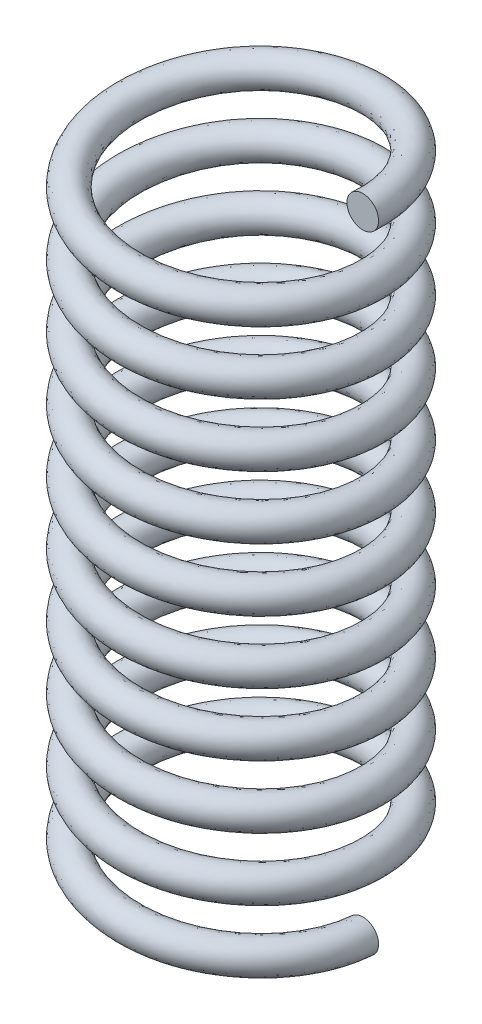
SolidWorks part; units mm, degrees
ref_plane "Front Plane" through (0, 0, 0) normal (0, 0, 1) x (1, 0, 0)
ref_plane "Top Plane" through (0, 0, 0) normal (0, 1, 0) x (1, 0, 0)
ref_plane "Right Plane" through (0, 0, 0) normal (1, 0, 0) x (0, 0, -1)
other "Configuration Table"
sketch "草图1" plane through (0, 0, 0) normal (0, 0, 1) x (1, 0, 0)
  line L0 (0, -65.5751) -> (0, -25.9626)
  line L1 (-7, -25.9626) -> (7, -25.9626) construction
  line L3 (-8.4824, -65.5751) -> (-6.9385, -65.5751) construction
sketch "草图2" plane through (0, 0, 0) normal (0, 0, 1) x (1, 0, 0)
  line L0 (0, -65.5751) -> (0, -25.9626) construction
  circle A0 centre (7.7, -25.9626) radius 1
  dimension "D1" = 2
  dimension "D2" = 7.7
sweep "扫描1" add profiles "草图2" path "草图1" parameters "D4"=3600
sketch "草图3" [suppressed] plane through (0, 0, 0) normal (0, 0, -1) x (-1, 0, 0)
  line L1 (-111.2126, 104.59) -> (123.6256, 104.59)
  line L2 (-111.2126, 104.59) -> (-111.2126, -62.5751)
  line L3 (-111.2126, -62.5751) -> (123.6256, -62.5751)
  line L4 (123.6256, 104.59) -> (123.6256, -62.5751)
  line L5 (-83.7164, -22.9626) -> (77.5665, -22.9626)
  line L6 (-83.7164, -22.9626) -> (-83.7164, -111.3063)
  line L7 (-83.7164, -111.3063) -> (77.5665, -111.3063)
  line L8 (77.5665, -22.9626) -> (77.5665, -111.3063)
